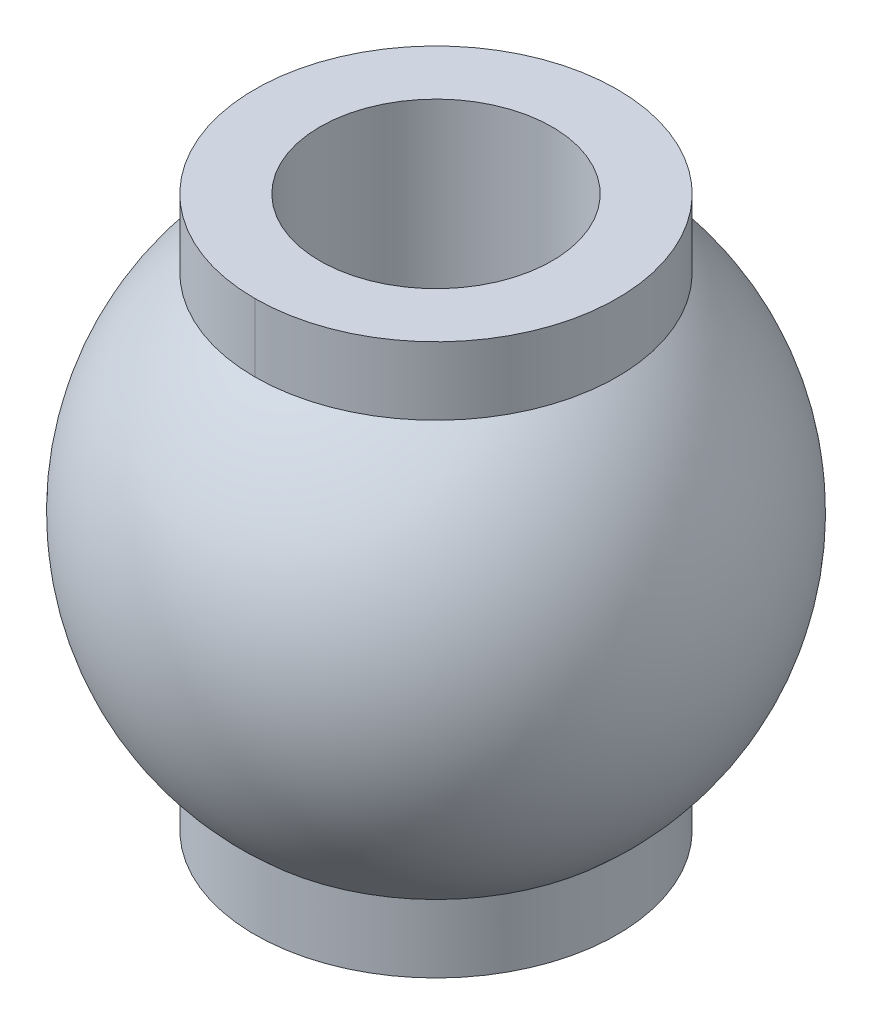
SolidWorks part; units mm, degrees
ref_plane "Front" through (0, 0, 0) normal (0, 0, 1) x (1, 0, 0)
ref_plane "Top" through (0, 0, 0) normal (0, 1, 0) x (1, 0, 0)
ref_plane "Right" through (0, 0, 0) normal (1, 0, 0) x (0, 0, -1)
sketch "Sketch1" plane through (0, 0, 0) normal (0, 0, 1) x (1, 0, 0)
  line L0 (0, 21.5067) -> (0, -21.5067) construction
  line L1 (3.175, 7.5311) -> (3.175, -7.5311)
  line L2 (3.175, -7.5311) -> (4.953, -7.5311)
  line L3 (4.953, -7.5311) -> (4.953, -5.6732)
  line L4 (3.175, 7.5311) -> (4.953, 7.5311)
  line L5 (4.953, 7.5311) -> (4.953, 5.6732)
  arc A0 (4.953, -5.6732) -> (4.953, 5.6732) centre (0, 0) ccw
  dimension "D3" = 7.5311
  dimension "D1" = 15.0622
  dimension "D2" = 6.35
  dimension "D4" = 9.906
revolve "Revolve1" add sketch "Sketch1" angle 360 about L0
